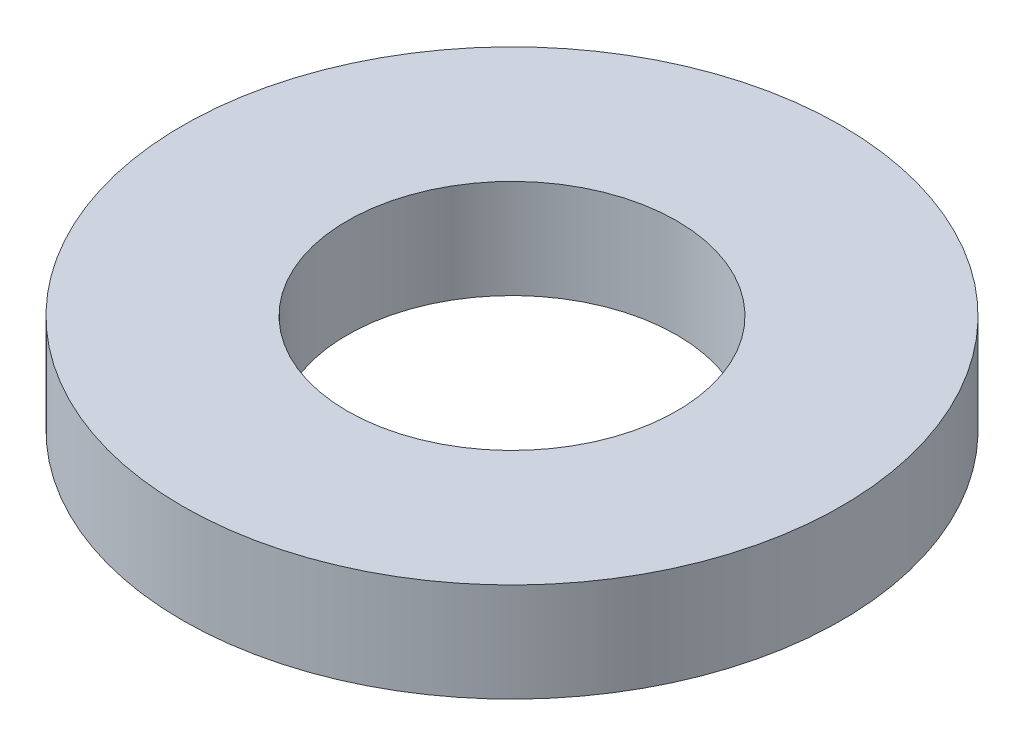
SolidWorks part; units mm, degrees
ref_plane "Front Plane" through (0, 0, 0) normal (0, 0, 1) x (1, 0, 0)
ref_plane "Top Plane" through (0, 0, 0) normal (0, 1, 0) x (1, 0, 0)
ref_plane "Right Plane" through (0, 0, 0) normal (1, 0, 0) x (0, 0, -1)
sketch "Sketch1" plane through (0, 0, 0) normal (0, 1, 0) x (1, 0, 0)
  circle A0 centre (0, 0) radius 50
  circle A1 centre (0, 0) radius 100
  dimension "D1" = 200
  dimension "D2" = 100
extrude "Boss-Extrude1" add sketch "Sketch1" along normal mid plane 30
